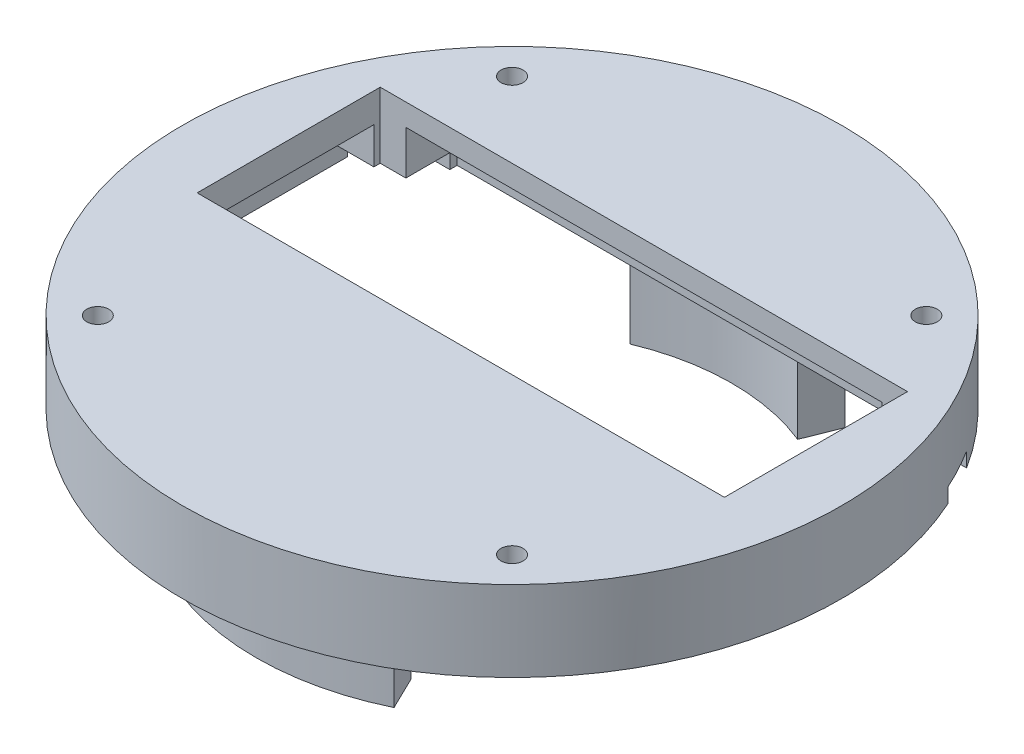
SolidWorks part; units mm, degrees
ref_plane "Front Plane" through (0, 0, 0) normal (0, 0, 1) x (1, 0, 0)
ref_plane "Top Plane" through (0, 0, 0) normal (0, 1, 0) x (1, 0, 0)
ref_plane "Right Plane" through (0, 0, 0) normal (1, 0, 0) x (0, 0, -1)
sketch "Sketch1" plane through (0, 0, 0) normal (0, 1, 0) x (1, 0, 0)
  circle A0 centre (0, 0) radius 45
  dimension "D1" = 90
extrude "Boss-Extrude1" add sketch "Sketch1" along normal blind 11
sketch "Sketch2" plane through (0, 0, 0) normal (0, -1, 0) x (1, 0, 0)
  line L3 (-38.0657, -24) -> (38.0657, -24)
  line L4 (-41, -18.5472) -> (-41, 13)
  line L5 (-41, 13) -> (41, 13)
  line L6 (41, -18.5472) -> (41, 13)
  arc A1 (-41, -18.5472) -> (-38.0657, -24) centre (0, 0) ccw
  arc A2 (41, -18.5472) -> (38.0657, -24) centre (0, 0) cw
  point P7 (0, -5.5)
extrude "Cut-Extrude1" cut sketch "Sketch2" against normal blind 2
sketch "Sketch3" plane through (0, 2, 0) normal (0, -1, 0) x (1, 0, 0)
  line L6 (36, -18) -> (-36, -18)
  line L7 (36, -18) -> (36, 7)
  line L8 (36, 7) -> (-36, 7)
  line L9 (-36, -18) -> (-36, 7)
extrude "Cut-Extrude2" cut sketch "Sketch3" against normal blind 9
sketch "Sketch4" plane through (0, 2, 0) normal (0, -1, 0) x (1, 0, 0)
  line L0 (-41, 13) -> (-41, -18.5472) construction
  line L1 (36, 7) -> (-9, 7)
  line L2 (36, 7) -> (36, 12)
  line L3 (36, 12) -> (-9, 12)
  line L4 (-9, 7) -> (-9, 12)
  line L5 (-36, 7) -> (-41, 7)
  line L6 (-36, 7) -> (-36, -17.1381)
  line L7 (-36, -17.1381) -> (-41, -17.1381)
  line L8 (-41, 7) -> (-41, -17.1381)
extrude "Cut-Extrude4" cut sketch "Sketch4" against normal blind 5
sketch "Sketch6" plane through (0, 0, 0) normal (0, -1, 0) x (1, 0, 0)
  line L0 (-13.1408, 26.9688) -> (-15.3091, 31.4187)
  line L2 (15.3091, 31.4187) -> (13.1408, 26.9688)
  line L3 (-11.5769, -27.6762) -> (-13.4871, -32.2428)
  line L4 (11.1507, -27.8507) -> (12.9906, -32.4461)
  arc A0 (-10.4993, -33.3357) -> (11.9514, -32.8431) centre (0, 0) ccw
  arc A1 (-9.0123, -28.6143) -> (10.2587, -28.1915) centre (0, 0) ccw
  arc A3 (10.2587, -28.1915) -> (11.1507, -27.8507) centre (0, 0) ccw
  arc A4 (11.9514, -32.8431) -> (12.9906, -32.4461) centre (0, 0) ccw
  arc A5 (-11.5769, -27.6762) -> (-9.0123, -28.6143) centre (0, 0) ccw
  arc A6 (-13.4871, -32.2428) -> (-10.4993, -33.3357) centre (0, 0) ccw
  arc A7 (13.1408, 26.9688) -> (-13.1408, 26.9688) centre (0, 0) ccw
  arc A8 (15.3091, 31.4187) -> (-15.3091, 31.4187) centre (0, 0) ccw
  dimension "D1" = 60
  dimension "D2" = 69.9
extrude "Boss-Extrude3" add sketch "Sketch6" along normal blind 12
sketch "Sketch8" plane through (0, 11, 0) normal (0, 1, 0) x (1, 0, 0)
  circle A0 centre (-28.2843, 28.2843) radius 1.5
  circle A1 centre (28.2843, 28.2843) radius 1.5
  circle A2 centre (28.2843, -28.2843) radius 1.5
  circle A3 centre (-28.2843, -28.2843) radius 1.5
extrude "Cut-Extrude5" cut sketch "Sketch8" against normal blind 11
sketch "Sketch9" plane through (0, 0, 0) normal (0, -1, 0) x (1, 0, 0)
  circle A0 centre (-28.2843, 28.2843) radius 2.5
  circle A1 centre (28.2843, 28.2843) radius 2.5
  circle A2 centre (-28.2843, -28.2843) radius 2.5
  circle A3 centre (28.2843, -28.2843) radius 2.5
extrude "Cut-Extrude6" cut sketch "Sketch9" against normal blind 4
sketch "Sketch11" plane through (0, 0, 0) normal (0, -1, 0) x (1, 0, 0)
  line L1 (32.5, -25) -> (-32.5, -25)
  line L2 (32.5, -25) -> (32.5, 25)
  line L3 (32.5, 25) -> (-32.5, 25)
  line L4 (-32.5, -25) -> (-32.5, 25)
  line L5 (32.5, -25) -> (-32.5, 25) construction
  line L6 (32.5, 25) -> (-32.5, -25) construction
  point P0 (0, 0)
extrude "Cut-Extrude8" cut sketch "Sketch11" against normal blind 8
